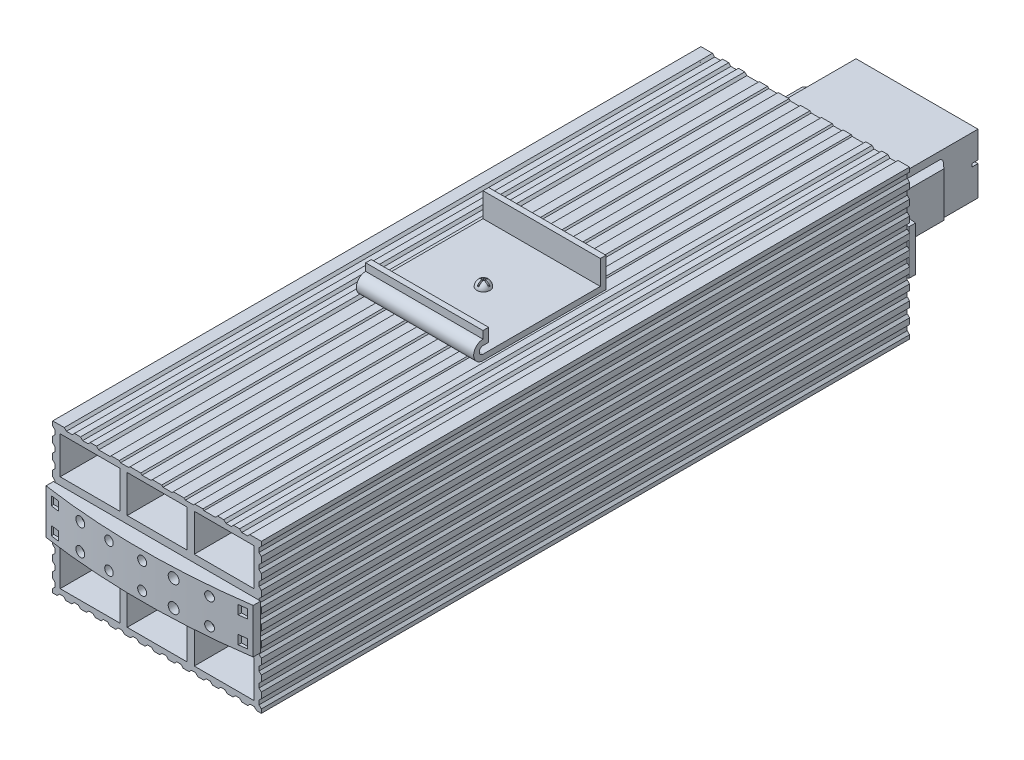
SolidWorks part; units mm, degrees
other "LUMP1"
ref_plane "Спереди" through (0, 0, 0) normal (0, 0, 1) x (1, 0, 0)
ref_plane "Сверху" through (0, 0, 0) normal (0, 1, 0) x (1, 0, 0)
ref_plane "Справа" through (0, 0, 0) normal (1, 0, 0) x (0, 0, -1)
imported_body "Импортированный1"
sketch "Эскиз1" plane through (0, 0, 220.98) normal (0, 0, 1) x (1, 0, 0)
  line L0 (0, 25.5171) -> (0, 17.6916) construction
  line L1 (-35.56, 23.9) -> (-34.76, 23.1)
  line L2 (-35.56, 25.4) -> (-35.56, -25.4) construction
  line L3 (-34.76, 23.1) -> (-34.76, 21.7)
  line L4 (-34.76, 21.7) -> (-35.56, 20.9)
  line L5 (-35.56, 20.9) -> (-36.3849, 20.9)
  line L6 (-36.3849, 20.9) -> (-36.3849, 23.9)
  line L7 (-36.3849, 23.9) -> (-35.56, 23.9)
  line L8 (35.56, 25.4) -> (-35.56, 25.4) construction
  line L9 (-35.56, 18.9) -> (-34.76, 18.1)
  line L10 (-34.76, 18.1) -> (-34.76, 16.7)
  line L11 (-34.76, 16.7) -> (-35.56, 15.9)
  line L12 (-35.56, 15.9) -> (-36.3849, 15.9)
  line L13 (-36.3849, 15.9) -> (-36.3849, 18.9)
  line L14 (-36.3849, 18.9) -> (-35.56, 18.9)
  line L15 (-35.56, 13.9) -> (-34.76, 13.1)
  line L16 (-34.76, 13.1) -> (-34.76, 11.7)
  line L17 (-34.76, 11.7) -> (-35.56, 10.9)
  line L18 (-35.56, 10.9) -> (-36.3849, 10.9)
  line L19 (-36.3849, 10.9) -> (-36.3849, 13.9)
  line L20 (-36.3849, 13.9) -> (-35.56, 13.9)
  line L21 (-35.56, 8.9) -> (-34.76, 8.1)
  line L22 (-34.76, 8.1) -> (-34.76, 6.7)
  line L23 (-34.76, 6.7) -> (-35.56, 5.9)
  line L24 (-35.56, 5.9) -> (-36.3849, 5.9)
  line L25 (-36.3849, 5.9) -> (-36.3849, 8.9)
  line L26 (-36.3849, 8.9) -> (-35.56, 8.9)
  line L27 (-35.56, 3.9) -> (-34.76, 3.1)
  line L28 (-34.76, 3.1) -> (-34.76, 1.7)
  line L29 (-34.76, 1.7) -> (-35.56, 0.9)
  line L30 (-35.56, 0.9) -> (-36.3849, 0.9)
  line L31 (-36.3849, 0.9) -> (-36.3849, 3.9)
  line L32 (-36.3849, 3.9) -> (-35.56, 3.9)
  line L33 (-35.56, -1.1) -> (-34.76, -1.9)
  line L34 (-34.76, -1.9) -> (-34.76, -3.3)
  line L35 (-34.76, -3.3) -> (-35.56, -4.1)
  line L36 (-35.56, -4.1) -> (-36.3849, -4.1)
  line L37 (-36.3849, -4.1) -> (-36.3849, -1.1)
  line L38 (-36.3849, -1.1) -> (-35.56, -1.1)
  line L39 (-35.56, -6.1) -> (-34.76, -6.9)
  line L40 (-34.76, -6.9) -> (-34.76, -8.3)
  line L41 (-34.76, -8.3) -> (-35.56, -9.1)
  line L42 (-35.56, -9.1) -> (-36.3849, -9.1)
  line L43 (-36.3849, -9.1) -> (-36.3849, -6.1)
  line L44 (-36.3849, -6.1) -> (-35.56, -6.1)
  line L45 (-35.56, -11.1) -> (-34.76, -11.9)
  line L46 (-34.76, -11.9) -> (-34.76, -13.3)
  line L47 (-34.76, -13.3) -> (-35.56, -14.1)
  line L48 (-35.56, -14.1) -> (-36.3849, -14.1)
  line L49 (-36.3849, -14.1) -> (-36.3849, -11.1)
  line L50 (-36.3849, -11.1) -> (-35.56, -11.1)
  line L51 (-35.56, -16.1) -> (-34.76, -16.9)
  line L52 (-34.76, -16.9) -> (-34.76, -18.3)
  line L53 (-34.76, -18.3) -> (-35.56, -19.1)
  line L54 (-35.56, -19.1) -> (-36.3849, -19.1)
  line L55 (-36.3849, -19.1) -> (-36.3849, -16.1)
  line L56 (-36.3849, -16.1) -> (-35.56, -16.1)
  line L57 (-35.56, -21.1) -> (-34.76, -21.9)
  line L58 (-34.76, -21.9) -> (-34.76, -23.3)
  line L59 (-34.76, -23.3) -> (-35.56, -24.1)
  line L60 (-35.56, -24.1) -> (-36.3849, -24.1)
  line L61 (-36.3849, -24.1) -> (-36.3849, -21.1)
  line L62 (-36.3849, -21.1) -> (-35.56, -21.1)
  line L63 (36.3849, -21.1) -> (35.56, -21.1)
  line L64 (36.3849, -24.1) -> (36.3849, -21.1)
  line L65 (35.56, -24.1) -> (36.3849, -24.1)
  line L66 (34.76, -23.3) -> (35.56, -24.1)
  line L67 (34.76, -21.9) -> (34.76, -23.3)
  line L68 (35.56, -21.1) -> (34.76, -21.9)
  line L69 (36.3849, -16.1) -> (35.56, -16.1)
  line L70 (36.3849, -19.1) -> (36.3849, -16.1)
  line L71 (35.56, -19.1) -> (36.3849, -19.1)
  line L72 (34.76, -18.3) -> (35.56, -19.1)
  line L73 (34.76, -16.9) -> (34.76, -18.3)
  line L74 (35.56, -16.1) -> (34.76, -16.9)
  line L75 (36.3849, -11.1) -> (35.56, -11.1)
  line L76 (36.3849, -14.1) -> (36.3849, -11.1)
  line L77 (35.56, -14.1) -> (36.3849, -14.1)
  line L78 (34.76, -13.3) -> (35.56, -14.1)
  line L79 (34.76, -11.9) -> (34.76, -13.3)
  line L80 (35.56, -11.1) -> (34.76, -11.9)
  line L81 (36.3849, -6.1) -> (35.56, -6.1)
  line L82 (36.3849, -9.1) -> (36.3849, -6.1)
  line L83 (35.56, -9.1) -> (36.3849, -9.1)
  line L84 (34.76, -8.3) -> (35.56, -9.1)
  line L85 (34.76, -6.9) -> (34.76, -8.3)
  line L86 (35.56, -6.1) -> (34.76, -6.9)
  line L87 (36.3849, -1.1) -> (35.56, -1.1)
  line L88 (36.3849, -4.1) -> (36.3849, -1.1)
  line L89 (35.56, -4.1) -> (36.3849, -4.1)
  line L90 (34.76, -3.3) -> (35.56, -4.1)
  line L91 (34.76, -1.9) -> (34.76, -3.3)
  line L92 (35.56, -1.1) -> (34.76, -1.9)
  line L93 (36.3849, 3.9) -> (35.56, 3.9)
  line L94 (36.3849, 0.9) -> (36.3849, 3.9)
  line L95 (35.56, 0.9) -> (36.3849, 0.9)
  line L96 (34.76, 1.7) -> (35.56, 0.9)
  line L97 (34.76, 3.1) -> (34.76, 1.7)
  line L98 (35.56, 3.9) -> (34.76, 3.1)
  line L99 (36.3849, 8.9) -> (35.56, 8.9)
  line L100 (36.3849, 5.9) -> (36.3849, 8.9)
  line L101 (35.56, 5.9) -> (36.3849, 5.9)
  line L102 (34.76, 6.7) -> (35.56, 5.9)
  line L103 (34.76, 8.1) -> (34.76, 6.7)
  line L104 (35.56, 8.9) -> (34.76, 8.1)
  line L105 (36.3849, 13.9) -> (35.56, 13.9)
  line L106 (36.3849, 10.9) -> (36.3849, 13.9)
  line L107 (35.56, 10.9) -> (36.3849, 10.9)
  line L108 (34.76, 11.7) -> (35.56, 10.9)
  line L109 (34.76, 13.1) -> (34.76, 11.7)
  line L110 (35.56, 13.9) -> (34.76, 13.1)
  line L111 (36.3849, 18.9) -> (35.56, 18.9)
  line L112 (36.3849, 15.9) -> (36.3849, 18.9)
  line L113 (35.56, 15.9) -> (36.3849, 15.9)
  line L114 (34.76, 16.7) -> (35.56, 15.9)
  line L115 (34.76, 18.1) -> (34.76, 16.7)
  line L116 (35.56, 18.9) -> (34.76, 18.1)
  line L117 (36.3849, 23.9) -> (35.56, 23.9)
  line L118 (36.3849, 20.9) -> (36.3849, 23.9)
  line L119 (35.56, 20.9) -> (36.3849, 20.9)
  line L120 (34.76, 21.7) -> (35.56, 20.9)
  line L121 (34.76, 23.1) -> (34.76, 21.7)
  line L122 (35.56, 23.9) -> (34.76, 23.1)
  dimension "D1" = 3
  dimension "D2" = 1.4
  dimension "D3" = 0.8
  dimension "D4" = 1.5
  dimension "D5" = 10
extrude "Вырез-Вытянуть1" cut sketch "Эскиз1" against normal up to surface (220.98 mm away)
sketch "Эскиз2" plane through (0, 0, 220.98) normal (0, 0, 1) x (1, 0, 0)
  line L0 (-34.06, -25.4) -> (-33.26, -24.6)
  line L1 (-35.56, -25.4) -> (35.56, -25.4) construction
  line L2 (-33.26, -24.6) -> (-31.86, -24.6)
  line L3 (-31.86, -24.6) -> (-31.06, -25.4)
  line L4 (-31.06, -25.4) -> (-31.06, -26.2855)
  line L5 (-31.06, -26.2855) -> (-34.06, -26.2855)
  line L6 (-34.06, -26.2855) -> (-34.06, -25.4)
  line L7 (-29.06, -25.4) -> (-28.26, -24.6)
  line L8 (-28.26, -24.6) -> (-26.86, -24.6)
  line L9 (-26.86, -24.6) -> (-26.06, -25.4)
  line L10 (-26.06, -25.4) -> (-26.06, -26.2855)
  line L11 (-26.06, -26.2855) -> (-29.06, -26.2855)
  line L12 (-29.06, -26.2855) -> (-29.06, -25.4)
  line L13 (-24.06, -25.4) -> (-23.26, -24.6)
  line L14 (-23.26, -24.6) -> (-21.86, -24.6)
  line L15 (-21.86, -24.6) -> (-21.06, -25.4)
  line L16 (-21.06, -25.4) -> (-21.06, -26.2855)
  line L17 (-21.06, -26.2855) -> (-24.06, -26.2855)
  line L18 (-24.06, -26.2855) -> (-24.06, -25.4)
  line L19 (-19.06, -25.4) -> (-18.26, -24.6)
  line L20 (-18.26, -24.6) -> (-16.86, -24.6)
  line L21 (-16.86, -24.6) -> (-16.06, -25.4)
  line L22 (-16.06, -25.4) -> (-16.06, -26.2855)
  line L23 (-16.06, -26.2855) -> (-19.06, -26.2855)
  line L24 (-19.06, -26.2855) -> (-19.06, -25.4)
  line L25 (-14.06, -25.4) -> (-13.26, -24.6)
  line L26 (-13.26, -24.6) -> (-11.86, -24.6)
  line L27 (-11.86, -24.6) -> (-11.06, -25.4)
  line L28 (-11.06, -25.4) -> (-11.06, -26.2855)
  line L29 (-11.06, -26.2855) -> (-14.06, -26.2855)
  line L30 (-14.06, -26.2855) -> (-14.06, -25.4)
  line L31 (-9.06, -25.4) -> (-8.26, -24.6)
  line L32 (-8.26, -24.6) -> (-6.86, -24.6)
  line L33 (-6.86, -24.6) -> (-6.06, -25.4)
  line L34 (-6.06, -25.4) -> (-6.06, -26.2855)
  line L35 (-6.06, -26.2855) -> (-9.06, -26.2855)
  line L36 (-9.06, -26.2855) -> (-9.06, -25.4)
  line L37 (-4.06, -25.4) -> (-3.26, -24.6)
  line L38 (-3.26, -24.6) -> (-1.86, -24.6)
  line L39 (-1.86, -24.6) -> (-1.06, -25.4)
  line L40 (-1.06, -25.4) -> (-1.06, -26.2855)
  line L41 (-1.06, -26.2855) -> (-4.06, -26.2855)
  line L42 (-4.06, -26.2855) -> (-4.06, -25.4)
  line L43 (0.94, -25.4) -> (1.74, -24.6)
  line L44 (1.74, -24.6) -> (3.14, -24.6)
  line L45 (3.14, -24.6) -> (3.94, -25.4)
  line L46 (3.94, -25.4) -> (3.94, -26.2855)
  line L47 (3.94, -26.2855) -> (0.94, -26.2855)
  line L48 (0.94, -26.2855) -> (0.94, -25.4)
  line L49 (5.94, -25.4) -> (6.74, -24.6)
  line L50 (6.74, -24.6) -> (8.14, -24.6)
  line L51 (8.14, -24.6) -> (8.94, -25.4)
  line L52 (8.94, -25.4) -> (8.94, -26.2855)
  line L53 (8.94, -26.2855) -> (5.94, -26.2855)
  line L54 (5.94, -26.2855) -> (5.94, -25.4)
  line L55 (10.94, -25.4) -> (11.74, -24.6)
  line L56 (11.74, -24.6) -> (13.14, -24.6)
  line L57 (13.14, -24.6) -> (13.94, -25.4)
  line L58 (13.94, -25.4) -> (13.94, -26.2855)
  line L59 (13.94, -26.2855) -> (10.94, -26.2855)
  line L60 (10.94, -26.2855) -> (10.94, -25.4)
  line L61 (15.94, -25.4) -> (16.74, -24.6)
  line L62 (16.74, -24.6) -> (18.14, -24.6)
  line L63 (18.14, -24.6) -> (18.94, -25.4)
  line L64 (18.94, -25.4) -> (18.94, -26.2855)
  line L65 (18.94, -26.2855) -> (15.94, -26.2855)
  line L66 (15.94, -26.2855) -> (15.94, -25.4)
  line L67 (20.94, -25.4) -> (21.74, -24.6)
  line L68 (21.74, -24.6) -> (23.14, -24.6)
  line L69 (23.14, -24.6) -> (23.94, -25.4)
  line L70 (23.94, -25.4) -> (23.94, -26.2855)
  line L71 (23.94, -26.2855) -> (20.94, -26.2855)
  line L72 (20.94, -26.2855) -> (20.94, -25.4)
  line L73 (25.94, -25.4) -> (26.74, -24.6)
  line L74 (26.74, -24.6) -> (28.14, -24.6)
  line L75 (28.14, -24.6) -> (28.94, -25.4)
  line L76 (28.94, -25.4) -> (28.94, -26.2855)
  line L77 (28.94, -26.2855) -> (25.94, -26.2855)
  line L78 (25.94, -26.2855) -> (25.94, -25.4)
  line L79 (30.94, -25.4) -> (31.74, -24.6)
  line L80 (31.74, -24.6) -> (33.14, -24.6)
  line L81 (33.14, -24.6) -> (33.94, -25.4)
  line L82 (33.94, -25.4) -> (33.94, -26.2855)
  line L83 (33.94, -26.2855) -> (30.94, -26.2855)
  line L84 (30.94, -26.2855) -> (30.94, -25.4)
  dimension "D1" = 3
  dimension "D2" = 1.4
  dimension "D3" = 0.8
  dimension "D5" = 1.5
  dimension "D4" = 14
extrude "Вырез-Вытянуть2" cut sketch "Эскиз2" against normal up to surface (220.98 mm away)
sketch "Эскиз3" plane through (0, 0, 220.98) normal (0, 0, 1) x (1, 0, 0)
  line L0 (-31.616, 25.4) -> (-30.8814, 24.6654)
  line L1 (35.56, 25.4) -> (-35.56, 25.4) construction
  line L2 (-30.8814, 24.6654) -> (-28.8881, 24.6654)
  line L3 (-28.8881, 24.6654) -> (-28.1535, 25.4)
  line L4 (-28.1535, 25.4) -> (-26.0902, 25.4)
  line L5 (-26.0902, 25.4) -> (-25.3556, 24.6654)
  line L6 (-25.3556, 24.6654) -> (-23.5022, 24.6654)
  line L7 (-23.5022, 24.6654) -> (-22.7675, 25.4)
  line L8 (-22.7675, 25.4) -> (-20.6343, 25.4)
  line L9 (-20.6343, 25.4) -> (-19.8997, 24.6654)
  line L10 (-19.8997, 24.6654) -> (-16.019, 24.6654)
  line L11 (-16.019, 24.6654) -> (-15.6517, 25.0327)
  line L12 (-15.6517, 25.0327) -> (-12.8703, 25.0327)
  line L13 (-12.8703, 25.0327) -> (-12.4264, 24.5887)
  line L14 (-12.4264, 24.5887) -> (-9.6429, 24.5887)
  line L15 (-9.6429, 24.5887) -> (-9.199, 25.0327)
  line L16 (-9.199, 25.0327) -> (-5.5496, 25.0327)
  line L17 (-5.5496, 25.0327) -> (-5.1057, 24.5887)
  line L18 (-5.1057, 24.5887) -> (-2.0467, 24.5887)
  line L19 (0, 25.4) -> (0, 20.2876) construction
  line L20 (-2.0467, 24.5887) -> (-1.6027, 25.0327)
  line L21 (-1.6027, 25.0327) -> (1.6027, 25.0327)
  line L22 (2.0467, 24.5887) -> (1.6027, 25.0327)
  line L23 (5.1057, 24.5887) -> (2.0467, 24.5887)
  line L24 (5.5496, 25.0327) -> (5.1057, 24.5887)
  line L25 (9.199, 25.0327) -> (5.5496, 25.0327)
  line L26 (9.6429, 24.5887) -> (9.199, 25.0327)
  line L27 (12.4264, 24.5887) -> (9.6429, 24.5887)
  line L28 (12.8703, 25.0327) -> (12.4264, 24.5887)
  line L29 (15.6517, 25.0327) -> (12.8703, 25.0327)
  line L30 (16.019, 24.6654) -> (15.6517, 25.0327)
  line L31 (19.8997, 24.6654) -> (16.019, 24.6654)
  line L32 (20.6343, 25.4) -> (19.8997, 24.6654)
  line L33 (22.7675, 25.4) -> (20.6343, 25.4)
  line L34 (23.5022, 24.6654) -> (22.7675, 25.4)
  line L35 (25.3556, 24.6654) -> (23.5022, 24.6654)
  line L36 (26.0902, 25.4) -> (25.3556, 24.6654)
  line L37 (28.1535, 25.4) -> (26.0902, 25.4)
  line L38 (28.8881, 24.6654) -> (28.1535, 25.4)
  line L39 (30.8814, 24.6654) -> (28.8881, 24.6654)
  line L40 (31.616, 25.4) -> (30.8814, 24.6654)
  line L41 (-31.616, 25.4) -> (-31.616, 26.1571)
  line L42 (-31.616, 26.1571) -> (-20.0025, 26.1571)
  line L43 (-20.0025, 31.75) -> (-20.0025, 25.4) construction
  line L44 (-20.0025, 26.1571) -> (-20.0025, 25.4)
  line L45 (-20.0025, 25.4) -> (20.0025, 25.4)
  line L46 (20.0025, 25.4) -> (20.0025, 31.75) construction
  line L47 (20.0025, 25.4) -> (20.0025, 26.1571)
  line L48 (20.0025, 26.1571) -> (31.616, 26.1571)
  line L49 (31.616, 26.1571) -> (31.616, 25.4)
  point P27 (0, 25.0327)
extrude "Вырез-Вытянуть3" cut sketch "Эскиз3" against normal up to surface (220.98 mm away)
sketch "Эскиз4" plane through (0, -10.16, 0) normal (0, -1, 0) x (1, 0, 0)
  line L0 (-18.5499, -8.4033) -> (-18.5499, -35.8686)
  line L1 (-18.5499, -35.8686) -> (-6.5617, -35.8686)
  line L2 (-6.5617, -35.8686) -> (-6.5617, -8.4033)
  line L3 (-6.5617, -8.4033) -> (-5.9617, -8.4033)
  line L4 (-5.9617, -8.4033) -> (-5.9617, -35.8686)
  line L5 (-5.9617, -35.8686) -> (6.0266, -35.8686)
  line L6 (6.0266, -35.8686) -> (6.0266, -8.4033)
  line L7 (6.0266, -8.4033) -> (6.6266, -8.4033)
  line L8 (6.6266, -8.4033) -> (6.6266, -35.8686)
  line L9 (6.6266, -35.8686) -> (18.5448, -35.8686)
  line L10 (18.5448, -35.8686) -> (18.5448, -8.4033)
  line L11 (18.5448, -8.4033) -> (19.1448, -8.4033)
  line L12 (19.1448, -8.4033) -> (19.1448, -36.2918)
  line L13 (19.1448, -36.2918) -> (-19.1499, -36.2918)
  line L14 (-19.1499, -36.2918) -> (-19.1499, -8.4033)
  line L15 (-19.1499, -8.4033) -> (-18.5499, -8.4033)
  line L17 (-18.2499, -35.56) -> (-18.2499, -30.48) construction
  line L18 (-5.6617, -35.56) -> (-5.6617, -30.48) construction
  line L19 (6.9266, -35.56) -> (6.9266, -30.48) construction
  line L20 (18.2448, -35.56) -> (18.2448, -30.48) construction
  dimension "D1" = 0.6
  dimension "D2" = 0.3
  dimension "D3" = 0.6
  dimension "D4" = 0.3
  dimension "D5" = 0.6
  dimension "D6" = 0.3
  dimension "D7" = 0.6
  dimension "D8" = 0.3
extrude "Вырез-Вытянуть4" cut sketch "Эскиз4" against normal blind 2
sketch "Эскиз5" plane through (0, -11.684, 0) normal (0, -1, 0) x (1, 0, 0)
  circle A0 centre (-12.5908, -33.02) radius 2.0359
extrude "Вырез-Вытянуть5" cut sketch "Эскиз5" against normal blind 0.5
sketch "Эскиз6" plane through (0, -11.184, 0) normal (0, -1, 0) x (1, 0, 0)
  line L0 (-12.5908, -30.9841) -> (-12.5908, -35.1828) construction
  line L1 (-12.4708, -32.4716) -> (-11.0908, -32.4716)
  line L2 (-13.8908, -33.1116) -> (-11.2908, -33.1116)
  line L3 (-13.8908, -33.1116) -> (-13.8908, -33.3516)
  line L4 (-13.8908, -33.3516) -> (-11.2908, -33.3516)
  line L5 (-11.2908, -33.1116) -> (-11.2908, -33.3516)
  line L6 (-13.5908, -33.7516) -> (-11.5908, -33.7516)
  line L7 (-13.5908, -33.7516) -> (-13.5908, -33.9916)
  line L8 (-13.5908, -33.9916) -> (-11.5908, -33.9916)
  line L9 (-11.5908, -33.7516) -> (-11.5908, -33.9916)
  line L10 (-14.0908, -32.4716) -> (-12.7108, -32.4716)
  line L11 (-14.0908, -32.4716) -> (-14.0908, -32.7116)
  line L12 (-14.0908, -32.7116) -> (-11.0908, -32.7116)
  line L13 (-11.0908, -32.4716) -> (-11.0908, -32.7116)
  line L14 (-12.7108, -31.253) -> (-12.4708, -31.253)
  line L15 (-12.7108, -31.253) -> (-12.7108, -32.4716)
  line L17 (-12.4708, -31.253) -> (-12.4708, -32.4716)
  circle A0 centre (-12.5908, -33.02) radius 2.0359 construction
  circle A1 centre (-12.5908, -33.02) radius 2.0359 construction
  dimension "D1" = 0.24
  dimension "D2" = 0.12
  dimension "D3" = 0.24
  dimension "D4" = 0.24
  dimension "D5" = 1.5
  dimension "D6" = 3
  dimension "D7" = 2.6
  dimension "D8" = 0.24
  dimension "D9" = 1.3
  dimension "D10" = 0.24
  dimension "D11" = 1
  dimension "D12" = 2
  dimension "D13" = 0.4
  dimension "D14" = 0.4
extrude "Бобышка-Вытянуть1" add sketch "Эскиз6" along normal blind 0.6
sketch "Эскиз7" plane through (0, -11.684, 0) normal (0, -1, 0) x (1, 0, 0)
  circle A0 centre (-0.0025, -33.02) radius 2.033
extrude "Вырез-Вытянуть6" cut sketch "Эскиз7" against normal blind 0.5
sketch "Эскиз8" plane through (0, -11.184, 0) normal (0, -1, 0) x (1, 0, 0)
  line L0 (-0.3942, -31.3886) -> (-0.3942, -34.0055)
  line L1 (-0.3942, -34.0055) -> (1.3481, -34.0055)
  line L2 (1.3481, -34.0055) -> (1.3481, -34.2455)
  line L3 (1.3481, -34.2455) -> (-0.6342, -34.2455)
  line L4 (-0.6342, -34.2455) -> (-0.6342, -31.3886)
  line L5 (-0.6342, -31.3886) -> (-0.3942, -31.3886)
  dimension "D1" = 0.24
  dimension "D2" = 0.24
extrude "Бобышка-Вытянуть2" add sketch "Эскиз8" along normal blind 0.6
sketch "Эскиз9" plane through (0, -11.684, 0) normal (0, -1, 0) x (1, 0, 0)
  circle A0 centre (12.5857, -33.02) radius 2.0678
extrude "Вырез-Вытянуть7" cut sketch "Эскиз9" against normal blind 0.5
sketch "Эскиз10" plane through (0, -11.184, 0) normal (0, -1, 0) x (1, 0, 0)
  line L0 (13.5349, -31.5862) -> (13.5349, -34.1127)
  line L1 (13.5349, -34.1127) -> (11.64, -31.5862)
  line L2 (11.64, -31.5862) -> (11.4, -31.5862)
  line L3 (11.4, -31.5862) -> (11.4, -34.4665)
  line L4 (11.4, -34.4665) -> (11.64, -34.4665)
  line L5 (11.64, -34.4665) -> (11.64, -31.9399)
  line L6 (11.64, -31.9399) -> (13.5349, -34.4665)
  line L7 (13.5349, -34.4665) -> (13.7749, -34.4665)
  line L8 (13.7749, -34.4665) -> (13.7749, -31.5862)
  line L9 (13.7749, -31.5862) -> (13.5349, -31.5862)
  dimension "D1" = 0.24
  dimension "D2" = 0.24
extrude "Бобышка-Вытянуть3" add sketch "Эскиз10" along normal blind 0.6
sketch "Эскиз11" plane through (0, 0, -38.1) normal (0, 0, -1) x (-1, 0, 0)
  line L0 (-20.7892, -10.16) -> (-20.7892, 10.16) construction
  line L1 (-20.7892, 1.0581) -> (20.7892, 1.0581)
  line L2 (-20.7892, 1.0581) -> (-20.7892, 0)
  line L3 (-20.7892, 0) -> (20.7892, 0)
  line L4 (20.7892, 1.0581) -> (20.7892, 0)
  line L5 (20.7892, 10.16) -> (20.7892, -10.16) construction
extrude "Вырез-Вытянуть8" cut sketch "Эскиз11" against normal blind 2
ref_plane "Плоскость1" through (0, 0, 226.98) normal (0, 0, 1) x (1, 0, 0)
sketch "Эскиз12" plane through (0, 0, 226.98) normal (0, 0, 1) x (1, 0, 0)
  line L0 (0, 0) -> (7.9044, 0) construction
  line L1 (-33.2126, 5.9484) -> (-30.3739, 5.9484)
  line L2 (-33.2126, 5.9484) -> (-33.2126, 2.8969)
  line L3 (-33.2126, 2.8969) -> (-30.3739, 2.8969)
  line L4 (-30.3739, 5.9484) -> (-30.3739, 2.8969)
  line L5 (33.6384, 5.9484) -> (30.7997, 5.9484)
  line L6 (33.6384, 5.9484) -> (33.6384, 2.8969)
  line L7 (33.6384, 2.8969) -> (30.7997, 2.8969)
  line L8 (30.7997, 5.9484) -> (30.7997, 2.8969)
  line L9 (30.7997, -5.9484) -> (30.7997, -2.8969)
  line L10 (33.6384, -2.8969) -> (30.7997, -2.8969)
  line L11 (33.6384, -5.9484) -> (33.6384, -2.8969)
  line L12 (33.6384, -5.9484) -> (30.7997, -5.9484)
  line L13 (-30.3739, -5.9484) -> (-30.3739, -2.8969)
  line L14 (-33.2126, -2.8969) -> (-30.3739, -2.8969)
  line L15 (-33.2126, -5.9484) -> (-33.2126, -2.8969)
  line L16 (-33.2126, -5.9484) -> (-30.3739, -5.9484)
  circle A0 centre (-22.0829, 4.4227) radius 1.6541
  circle A1 centre (-11.5711, 4.4227) radius 1.5258
  circle A2 centre (0, 4.4227) radius 1.5258
  circle A3 centre (10.512, 4.4227) radius 1.7797
  circle A4 centre (22.0017, 4.4227) radius 1.5258
  circle A5 centre (22.0017, -4.4227) radius 1.5258
  circle A6 centre (10.512, -4.4227) radius 1.7797
  circle A7 centre (0, -4.4227) radius 1.5258
  circle A8 centre (-11.5711, -4.4227) radius 1.5258
  circle A9 centre (-22.0829, -4.4227) radius 1.6541
extrude "Вырез-Вытянуть9" cut sketch "Эскиз12" against normal blind 4
ref_plane "Плоскость2" through (0, 0, -5) normal (0, 0, -1) x (-1, 0, 0)
sketch "Эскиз13" plane through (0, 0, -5) normal (0, 0, -1) x (-1, 0, 0)
  line L1 (-32.5253, 6.2342) -> (-29.8673, 6.2342)
  line L2 (-32.5253, 6.2342) -> (-32.5253, 3.5762)
  line L3 (-32.5253, 3.5762) -> (-29.8673, 3.5762)
  line L4 (-29.8673, 6.2342) -> (-29.8673, 3.5762)
  line L5 (33.5046, 6.2342) -> (30.9865, 6.2342)
  line L6 (33.5046, 6.2342) -> (33.5046, 3.5762)
  line L7 (33.5046, 3.5762) -> (30.9865, 3.5762)
  line L8 (30.9865, 6.2342) -> (30.9865, 3.5762)
  line L9 (33.5046, -6.0065) -> (30.9865, -6.0065)
  line L10 (33.5046, -6.0065) -> (33.5046, -2.9988)
  line L11 (33.5046, -2.9988) -> (30.9865, -2.9988)
  line L12 (30.9865, -6.0065) -> (30.9865, -2.9988)
  line L13 (-32.5253, -6.0065) -> (-29.8673, -6.0065)
  line L14 (-32.5253, -6.0065) -> (-32.5253, -2.9988)
  line L15 (-32.5253, -2.9988) -> (-29.8673, -2.9988)
  line L16 (-29.8673, -6.0065) -> (-29.8673, -2.9988)
extrude "Вырез-Вытянуть10" cut sketch "Эскиз13" against normal blind 4
sketch "Эскиз14" plane through (0, 27.305, 0) normal (0, 1, 0) x (1, 0, 0)
  line L0 (20.0025, -109.855) -> (-19.7606, -109.855) construction
  line L1 (20.0025, -129.8575) -> (20.0025, -89.8525) construction
  line L2 (2.3713, -109.855) -> (-2.0951, -109.855)
  arc A0 (2.3713, -109.855) -> (-2.0951, -109.855) centre (0.1381, -109.855) cw
revolve "Повернуть1" add sketch "Эскиз14" angle 180 about L0
ref_plane "Плоскость3" through (0, 32.305, 0) normal (0, 1, 0) x (1, 0, 0)
sketch "Эскиз15" plane through (0, 32.305, 0) normal (0, 1, 0) x (1, 0, 0)
  line L0 (0.25, -107.6246) -> (0.25, -112.0854) construction
  line L1 (-2.0951, -109.855) -> (2.3713, -109.855) construction
  line L2 (0, -107.905) -> (0.5, -107.905)
  line L3 (0.5, -107.905) -> (0.5, -109.605)
  line L4 (0.5, -109.605) -> (2.2, -109.605)
  line L5 (2.2, -109.605) -> (2.2, -110.105)
  line L6 (2.2, -110.105) -> (0.5, -110.105)
  line L7 (0.5, -110.105) -> (0.5, -111.805)
  line L8 (0.5, -111.805) -> (0, -111.805)
  line L9 (0, -111.805) -> (0, -110.105)
  line L10 (0, -110.105) -> (-1.7, -110.105)
  line L11 (-1.7, -110.105) -> (-1.7, -109.605)
  line L12 (-1.7, -109.605) -> (0, -109.605)
  line L13 (0, -109.605) -> (0, -107.905)
  circle A0 centre (0.1381, -109.855) radius 2.2332 construction
  dimension "D1" = 0.25
  dimension "D2" = 0.25
  dimension "D3" = 0.25
  dimension "D4" = 0.25
  dimension "D5" = 0.25
  dimension "D6" = 0.25
  dimension "D7" = 0.25
  dimension "D8" = 0.25
  dimension "D9" = 1.7
  dimension "D10" = 1.7
  dimension "D11" = 1.7
  dimension "D12" = 1.7
extrude "Вырез-Вытянуть11" cut sketch "Эскиз15" against normal blind 4
